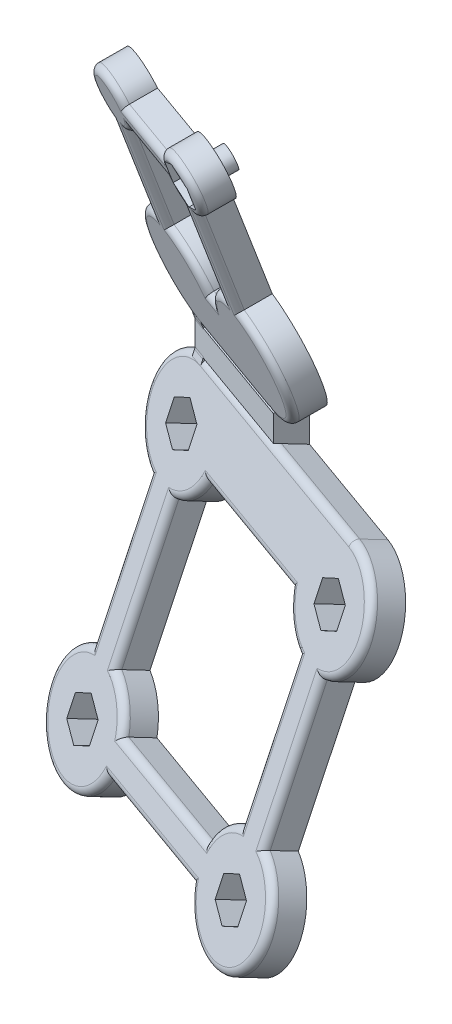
SolidWorks part; units mm, degrees
ref_plane "Plan de face" through (0, 0, 0) normal (0, 0, 1) x (1, 0, 0)
ref_plane "Plan de dessus" through (0, 0, 0) normal (0, 1, 0) x (1, 0, 0)
ref_plane "Plan de droite" through (0, 0, 0) normal (1, 0, 0) x (0, 0, -1)
sketch "Esquisse1" plane through (0, 0, 0) normal (1, 0, 0) x (0, 0, -1)
  line L0 (-6, 17) -> (0, 0) construction
  line L3 (0, 0) -> (-6, -17) construction
  dimension "D1" = 17
  dimension "D2" = 6
  dimension "D3" = 17
  dimension "D4" = 6
sketch "Esquisse2" plane through (0, 0, 0) normal (0, 1, 0) x (1, 0, 0)
  line L0 (0, 0) -> (42, -15) construction
  dimension "D1" = 42
  dimension "D2" = 15
ref_plane "Plan1" through (0, 0, 0) normal (0.3192, 0.3154, -0.8937) x (-0.9477, 0.1062, -0.301)
ref_plane "Plan2" through (0, 0, 0) normal (0.3192, -0.3154, -0.8937) x (-0.9477, -0.1062, -0.301)
sketch "Esquisse6" plane through (0, 0, 0) normal (0.3192, 0.3154, -0.8937) x (-0.9477, 0.1062, -0.301)
  line L15 (-12.9143, 33.8873) -> (-14.5229, 19.607)
  line L16 (-17.5041, 19.9429) -> (-15.8955, 34.2231)
  line L17 (-17.7887, 4.0165) -> (-0.8955, 2.1135)
  line L18 (-9.0617, 13.5998) -> (-7.2717, 13.3982)
  line L19 (-0.6109, 18.0399) -> (0.9977, 32.3201)
  line L20 (2.3702, 17.7041) -> (3.9788, 31.9843)
  line L21 (-10.4729, 35.8343) -> (-0.9494, 34.7615)
  line L22 (-10.1371, 38.8154) -> (-0.6135, 37.7426)
  line L23 (0, 0) -> (-44.3179, 4.9923) construction
  arc A12 (-10.1371, 38.8154) -> (-15.8955, 34.2231) centre (-13.9898, 37.74) ccw
  arc A13 (3.9788, 31.9843) -> (-0.6135, 37.7426) centre (2.9033, 35.837) ccw
  arc A14 (-17.5041, 19.9429) -> (-17.7887, 4.0165) centre (-16.8932, 11.9662) ccw
  arc A15 (-0.8955, 2.1135) -> (2.3702, 17.7041) centre (0, 10.0632) ccw
  arc A16 (-9.0617, 13.5998) -> (-14.5229, 19.607) centre (-16.8932, 11.9662) ccw
  arc A17 (-0.6109, 18.0399) -> (-7.2717, 13.3982) centre (0, 10.0632) ccw
  arc A18 (-0.9494, 34.7615) -> (0.9977, 32.3201) centre (2.9033, 35.837) ccw
  arc A19 (-12.9143, 33.8873) -> (-10.4729, 35.8343) centre (-13.9898, 37.74) ccw
  point P3 (0, 0)
  point P5 (0, 0)
  dimension "D1" = 8
  dimension "D4" = 1.5
  dimension "D21" = 17
  dimension "D22" = 8
  dimension "D23" = 8
  dimension "D5" = 1.5
  dimension "D6" = 2
  dimension "D25" = 1.5
  dimension "D26" = 1.5
  dimension "D30" = 1.5
  dimension "D31" = 1.5
extrude "Boss.-Extru.2" add sketch "Esquisse6" along normal blind 4.4
sketch "Esquisse7" plane through (0, 0, 0) normal (0.3192, -0.3154, -0.8937) x (-0.9477, -0.1062, -0.301)
  line L0 (-36.6693, -6.1433) -> (-0.8955, -2.1135)
  line L1 (-27.9423, -15.7267) -> (-7.2717, -13.3982)
  line L2 (0, 0) -> (-44.3179, -4.9923) construction
  line L3 (-32.4388, -21.3648) -> (-30.1103, -42.0354)
  line L4 (-1.6336, -17.8947) -> (0.6949, -38.5653)
  line L5 (-37.4074, -21.9245) -> (-35.0789, -42.5951)
  line L6 (3.335, -17.335) -> (5.6634, -38.0056)
  line L7 (-24.4722, -46.5319) -> (-3.8016, -44.2034)
  line L8 (-23.9125, -51.5004) -> (-3.2419, -49.1719)
  arc A0 (-36.6693, -6.1433) -> (-37.4074, -21.9245) centre (-35.7737, -14.0931) ccw
  arc A1 (3.335, -17.335) -> (-0.8955, -2.1135) centre (0, -10.0632) ccw
  arc A2 (-35.0789, -42.5951) -> (-23.9125, -51.5004) centre (-31.7439, -49.8668) ccw
  arc A3 (0.6949, -38.5653) -> (-3.8016, -44.2034) centre (4.0298, -45.837) ccw
  arc A4 (-7.2717, -13.3982) -> (-1.6336, -17.8947) centre (0, -10.0632) ccw
  arc A5 (-32.4388, -21.3648) -> (-27.9423, -15.7267) centre (-35.7737, -14.0931) ccw
  arc A6 (-3.2419, -49.1719) -> (5.6634, -38.0056) centre (4.0298, -45.837) ccw
  arc A7 (-24.4722, -46.5319) -> (-30.1103, -42.0354) centre (-31.7439, -49.8668) ccw
  dimension "D1" = 16
  dimension "D2" = 16
  dimension "D5" = 16
  dimension "D6" = 16
  dimension "D3" = 36
  dimension "D4" = 10.5
  dimension "D7" = 2.5
  dimension "D8" = 2.5
  dimension "D9" = 36
  dimension "D10" = 36
  dimension "D11" = 2.5
  dimension "D12" = 2.5
  dimension "D13" = 2.5
  dimension "D14" = 2.5
  dimension "D15" = 2.5
  dimension "D16" = 5
  dimension "D17" = 2
extrude "Boss.-Extru.4" add sketch "Esquisse7" along normal blind 4.4 separate body
ref_plane "Plan3" through (0, 0, 30) normal (0, 0, 1) x (1, 0, 0)
sketch "Esquisse9" plane through (1.4043, 1.3878, -3.9321) normal (0.3192, 0.3154, -0.8937) x (-0.9477, 0.1062, -0.301)
  circle A0 centre (-13.9898, 37.74) radius 1.6
  dimension "D1" = 3.2
extrude "Boss.-Extru.5" add sketch "Esquisse9" along normal blind 1.75
pattern_linear "Répétition linéaire1" count 2 spacing 17 along (0.9417, 0, 0.3363) count 2 spacing 36 along (-0.1061, 0.949, 0.297) of "Boss.-Extru.5"
sketch "Esquisse10" plane through (0, 0, 0) normal (-0.3192, -0.3154, 0.8937) x (0.9477, -0.1062, 0.301)
  circle A0 centre (13.9898, 37.74) radius 1.5
  dimension "D1" = 3
extrude "Enlèv. mat.-Extru.1" cut sketch "Esquisse10" against normal up to next
pattern_linear "Répétition linéaire2" count 2 spacing 17 count 2 spacing 36
sketch "Esquisse11" plane through (1.4043, -1.3878, -3.9321) normal (0.3192, -0.3154, -0.8937) x (-0.9477, -0.1062, -0.301)
  circle A0 centre (-31.7439, -49.8668) radius 1.6
  dimension "D1" = 3.2
extrude "Boss.-Extru.6" add sketch "Esquisse11" along normal blind 1.75
pattern_linear "Répétition linéaire3" count 2 spacing 36 along (0.1061, 0.949, -0.297) count 2 spacing 36 along (-0.9417, 0, -0.3363) of "Boss.-Extru.6"
sketch "Esquisse12" plane through (0, 0, 0) normal (-0.3192, 0.3154, 0.8937) x (0.9477, 0.1062, 0.301)
  circle A0 centre (31.7439, -49.8668) radius 1.5
  dimension "D1" = 3
extrude "Enlèv. mat.-Extru.2" cut sketch "Esquisse12" against normal up to next
pattern_linear "Répétition linéaire4" count 2 spacing 36 along (0.1061, 0.949, -0.297) count 2 spacing 36 along (-0.9417, 0, -0.3363) of "Enlèv. mat.-Extru.2"
sketch "Esquisse13" plane through (0, 0, 0) normal (-0.3192, -0.3154, 0.8937) x (0.9477, -0.1062, 0.301)
  line L0 (15.8955, 34.2231) -> (17.5041, 19.9429) construction
  line L1 (16.9003, 36.4701) -> (16.5448, 39.6255)
  line L2 (16.5448, 39.6255) -> (13.6344, 40.8954)
  line L3 (13.6344, 40.8954) -> (11.0794, 39.0099)
  line L4 (11.0794, 39.0099) -> (11.4348, 35.8544)
  line L5 (11.4348, 35.8544) -> (14.3453, 34.5845)
  line L6 (14.3453, 34.5845) -> (16.9003, 36.4701)
  circle A0 centre (13.9898, 37.74) radius 2.75 construction
  dimension "D1" = 5.5
extrude "Enlèv. mat.-Extru.3" cut sketch "Esquisse13" against normal blind 4
pattern_linear "Répétition linéaire5" count 2 spacing 36 along (0.1061, -0.949, -0.297) count 2 spacing 36 along (0.9417, 0, 0.3363) of "Enlèv. mat.-Extru.3"
sketch "Esquisse14" plane through (0, 0, 0) normal (-0.3192, 0.3154, 0.8937) x (0.9477, 0.1062, 0.301)
  line L0 (37.4074, -21.9245) -> (35.0789, -42.5951) construction
  line L1 (31.3885, -53.0223) -> (34.2989, -51.7524)
  line L2 (34.2989, -51.7524) -> (34.6544, -48.5969)
  line L3 (34.6544, -48.5969) -> (32.0994, -46.7113)
  line L4 (32.0994, -46.7113) -> (29.1889, -47.9812)
  line L5 (29.1889, -47.9812) -> (28.8335, -51.1367)
  line L6 (28.8335, -51.1367) -> (31.3885, -53.0223)
  circle A0 centre (31.7439, -49.8668) radius 2.75 construction
  dimension "D1" = 5.5
extrude "Enlèv. mat.-Extru.4" cut sketch "Esquisse14" against normal blind 4
pattern_linear "Répétition linéaire6" count 2 spacing 36 along (-0.9417, 0, -0.3363) count 2 spacing 36 along (0.1061, 0.949, -0.297) of "Enlèv. mat.-Extru.4"
sketch "Esquisse16" plane through (0, 0, 0) normal (0, 1, 0) x (1, 0, 0)
  line L0 (15.7361, -5.3729) -> (20.4448, -7.0546)
  line L1 (15.7361, -5.3729) -> (10.5902, -19.7816)
  line L2 (10.5902, -19.7816) -> (15.8995, -19.7816)
  line L3 (15.8995, -19.7816) -> (20.4448, -7.0546)
  line L4 (0, 0) -> (42, -15) construction
  line L5 (-29.7123, -30) -> (29.7123, -30) construction
  line L6 (9.9921, -3.3215) -> (8.2957, -2.7156) construction
  dimension "D1" = 5
  dimension "D2" = 15.5
  dimension "D3" = 15.3
extrude "Boss.-Extru.10" [suppressed] add sketch "Esquisse16" along normal up to surface (51.6909 mm away)
sketch "Esquisse18" [suppressed] plane through (0, 0, 18.3517) normal (0, 0, 1) x (1, 0, 0)
  line L0 (0, 0) -> (42, 0) construction
  line L1 (1.1008, 0) -> (26.1008, 0)
  line L2 (1.1008, 0) -> (1.1008, 7)
  line L3 (1.1008, 7) -> (26.1008, 7)
  line L4 (26.1008, 0) -> (26.1008, 7)
  line L6 (11.1008, 41.3365) -> (11.1008, 0) construction
  dimension "D1" = 7
  dimension "D2" = 25
  dimension "D3" = 10
extrude "Boss.-Extru.11" [suppressed] add sketch "Esquisse18" against normal blind 5
ref_plane "nervures" through (-1.0608, 9.4895, 2.9704) normal (-0.1061, 0.949, 0.297) x (0.9944, 0.1012, 0.0317)
sketch "Esquisse28" [suppressed] plane through (-1.0608, 9.4895, 2.9704) normal (-0.1061, 0.949, 0.297) x (0.9944, 0.1012, 0.0317)
  line L0 (15.7467, -5.3368) -> (4.8552, -1.6455)
  line L1 (4.8552, -1.6455) -> (4.8552, -12.2042)
  line L2 (4.8552, -12.2042) -> (12.5369, -14.8076)
  line L3 (12.5369, -14.8076) -> (15.7467, -5.3368)
  line L5 (13.9456, -10.651) -> (12.3285, -15.4227) construction
  dimension "D1" = 10
extrude "Boss.-Extru.14" [suppressed] add sketch "Esquisse28" against normal blind 5
sketch "Esquisse29" [suppressed] plane through (-1.0608, 9.4895, 2.9704) normal (-0.1061, 0.949, 0.297) x (0.9944, 0.1012, 0.0317)
  line L0 (31.3736, -10.6329) -> (20.4821, -6.9416)
  line L1 (20.4821, -6.9416) -> (18.8772, -11.6771)
  line L2 (18.8772, -11.6771) -> (31.0197, -11.6771)
  line L3 (31.0197, -11.6771) -> (31.3736, -10.6329)
  line L4 (17.6078, -15.4227) -> (19.225, -10.651) construction
  line L5 (27.2438, -15.4227) -> (17.6078, -15.4227) construction
  dimension "D1" = 5
extrude "Boss.-Extru.15" [suppressed] add sketch "Esquisse29" against normal blind 5
sketch "Esquisse30" [suppressed] plane through (20.3666, 0, 7.2738) normal (0.9417, 0, 0.3363) x (0.3363, 0, -0.9417)
  line L0 (-9.6038, 47.9168) -> (1.7511, 51.6909)
  line L1 (1.7511, 51.6909) -> (1.7511, 13.7544) construction
  line L2 (1.7511, 51.6909) -> (-9.6038, 47.9168) construction
  line L3 (1.7511, 51.6909) -> (1.7511, 13.7544)
  line L4 (1.7511, 13.7544) -> (-9.6038, 47.9168)
extrude "Enlèv. mat.-Extru.5" [suppressed] cut sketch "Esquisse30" against normal blind 5
sketch "Esquisse34" plane through (0, 0, 0) normal (0, 1, 0) x (1, 0, 0)
  line L4 (20.4448, -7.0546) -> (15.7361, -5.3729)
  line L5 (15.8995, -19.7816) -> (20.4448, -7.0546)
  line L6 (10.5902, -19.7816) -> (15.8995, -19.7816)
  line L7 (15.7361, -5.3729) -> (10.5902, -19.7816)
  line L8 (20.4448, -7.0546) -> (15.7361, -5.3729)
  line L9 (15.8995, -19.7816) -> (20.4448, -7.0546)
  line L10 (10.5902, -19.7816) -> (15.8995, -19.7816)
  line L11 (15.7361, -5.3729) -> (10.5902, -19.7816)
  dimension "D1" = 0
extrude "Boss.-Extru.17" [suppressed] add sketch "Esquisse34" against normal up to surface (46.4219 mm away)
sketch "Esquisse31" [suppressed] plane through (20.3666, 0, 7.2738) normal (0.9417, 0, 0.3363) x (0.3363, 0, -0.9417)
  line L0 (-8.0267, 43.172) -> (1.7511, 13.7544) construction
  line L1 (-3.611, 29.8866) -> (0.174, 18.4992)
  arc A0 (-3.611, 29.8866) -> (0.174, 18.4992) centre (-1.7185, 24.1929) ccw
  dimension "D1" = 12
  dimension "D2" = 20
extrude "Enlèv. mat.-Extru.6" [suppressed] cut sketch "Esquisse31" against normal blind 5
fillet "Congé1" [suppressed] radius 4
mirror "Symétrie4" [suppressed] about plane through (0, 0, 0) normal (0, 1, 0)
fillet "Congé2" [suppressed] radius 4
ref_plane "liaison" through (1.0608, 0, 0.3789) normal (-0.9417, 0, -0.3363) x (-0.3363, 0, 0.9417)
sketch "Esquisse35" plane through (1.0608, 0, 0.3789) normal (-0.9417, 0, -0.3363) x (-0.3363, 0, 0.9417)
  line L0 (-3.5446, 3.2857) -> (-3.5446, -3.2857)
  line L1 (-3.5446, 3.2857) -> (0.6308, 1.8979) construction
  line L3 (-3.5446, -3.2857) -> (0.6308, -1.8979) construction
  line L4 (0.6308, -1.8979) -> (0.6308, 1.8979)
  line L5 (-3.5446, 3.2857) -> (0.6308, 1.8979)
  line L6 (-3.5446, -3.2857) -> (0.6308, -1.8979)
extrude "Boss.-Extru.18" add sketch "Esquisse35" against normal up to vertex
sketch "Esquisse36" [suppressed] plane through (0, 0, 18.3517) normal (0, 0, 1) x (1, 0, 0)
  line L0 (0, 0) -> (42, 0) construction
  line L1 (26.1008, -7) -> (26.1008, 7) construction
  circle A0 centre (21.1008, 0) radius 2.15
  dimension "D1" = 4.3
  dimension "D2" = 5
extrude "Enlèv. mat.-Extru.7" [suppressed] cut sketch "Esquisse36" against normal blind 5
pattern_linear "Répétition linéaire7" [suppressed] count 2 spacing 15
sketch "Esquisse39" [suppressed] plane through (0, 0, 13.3517) normal (0, 0, -1) x (-1, 0, 0)
  circle A0 centre (-6.1008, 0) radius 5
  dimension "D1" = 10
extrude "Enlèv. mat.-Extru.13" [suppressed] cut sketch "Esquisse39" along normal through all
pattern_linear "Répétition linéaire8" [suppressed] count 2 spacing 15
fillet "Congé40" radius 1 3 edges at (-7.3047, -8.2882, 0.3164) (17.8, -1.8979, 7.027) (41.476, -8.2882, 17.7381)
fillet "Congé5" radius 1
fillet "Congé38" radius 1
fillet "Congé6" radius 1
fillet "Congé7" [suppressed] radius 1
fillet "Congé13" radius 1 5 edges at (34.4038, -26.0673, 21.4873) (34.8108, -49.02, 29.7336) (-9.7465, -49.02, 13.8203) (12.8671, -46.0243, 20.8393) (-4.2076, -26.0673, 7.6975)
fillet "Congé14" radius 1 8 edges at (16.6861, -11.8619, 10.1459) (4.7272, -14.8576, 6.9322) (0.4448, -26.5707, 9.5368) (2.1083, -38.2838, 14.2649) (13.3975, -41.2795, 19.3541) (25.3565, -38.2838, 22.5678) (29.6388, -26.5707, 19.9632) (27.9753, -14.8576, 15.2351)
fillet "Congé16" [suppressed] radius 1
fillet "Congé19" [suppressed] radius 1
fillet "Congé20" [suppressed] radius 1
fillet "Congé37" radius 1 1 edges at (23.536, 9.5545, 11.7779)
fillet "Congé39" radius 1 2 edges at (-7.4205, 8.7747, 0.4467) (7.9464, 1.8979, 3.5079)
fillet "Congé22" radius 1
fillet "Congé26" radius 1 8 edges at (7.7396, 11.8619, 6.9507) (4.3347, 15.193, 6.9103) (-0.1833, 23.765, 8.3222) (0.2122, 31.4183, 11.1646) (5.4124, 32.6789, 13.4667) (10.8945, 31.4183, 14.9797) (13.0011, 23.765, 13.0309) (10.3998, 15.193, 9.0764)
fillet "Congé29" radius 1 5 edges at (5.0942, 35.5258, 14.3579) (-2.9543, 23.2807, 7.1616) (15.8805, 23.2807, 13.8883) (-5.7152, 36.7864, 10.9423) (15.6217, 36.7864, 18.5626)
fillet "Congé36" [suppressed] radius 1
fillet "Congé41" [suppressed] radius 1
fillet "Congé42" [suppressed] radius 1
fillet "Congé43" [suppressed] radius 1
fillet "Congé44" [suppressed] radius 1
fillet "Congé45" [suppressed] radius 1
fillet "Congé46" [suppressed] radius 1
fillet "Congé47" [suppressed] radius 1
fillet "Congé48" [suppressed] radius 1
fillet "Congé49" [suppressed] radius 1
fillet "Congé50" [suppressed] radius 1
fillet "Congé51" [suppressed] radius 1
fillet "Congé52" [suppressed] radius 1
fillet "Congé53" [suppressed] radius 1
fillet "Congé54" [suppressed] radius 1
fillet "Congé55" [suppressed] radius 1
fillet "Congé57" [suppressed] radius 1
fillet "Congé58" [suppressed] radius 1
sketch "Esquisse40" plane through (1.0608, 0, 0.3789) normal (-0.9417, 0, -0.3363) x (-0.3363, 0, 0.9417)
  line L0 (-4.7475, -4.7393) -> (0.9462, -2.8469)
  line L1 (-4.7475, -4.7393) -> (-5.0629, -3.7904)
  line L2 (-5.0629, -3.7904) -> (-5.0629, 3.7904)
  line L3 (0.6308, -1.7361) -> (0.6308, 1.8979) construction
  line L4 (0.6819, -2.0515) -> (0.9462, -2.8469) construction
  line L5 (0.6308, -1.7361) -> (0.6308, 1.7361)
  line L6 (0.6819, -2.0515) -> (0.9462, -2.8469)
  line L7 (19.5403, 0) -> (-19.5403, 0) construction
  line L8 (-5.0629, -3.7904) -> (-0.1427, -18.5935) construction
  line L9 (-5.0629, -3.7904) -> (-0.3181, -2.2133) construction
  line L10 (0.6819, 2.0515) -> (0.9462, 2.8469)
  line L11 (-4.7475, 4.7393) -> (-5.0629, 3.7904)
  line L12 (-4.7475, 4.7393) -> (0.9462, 2.8469)
  arc A0 (0.6308, -1.7361) -> (0.6819, -2.0515) centre (1.6308, -1.7361) ccw construction
  arc A1 (0.6308, -1.7361) -> (0.6819, -2.0515) centre (1.6308, -1.7361) ccw
  arc A2 (0.6308, 1.7361) -> (0.6819, 2.0515) centre (1.6308, 1.7361) cw
  point P19 (0.6308, 0)
  point P23 (-5.0629, 0)
extrude "Boss.-Extru.19" add sketch "Esquisse40" along normal blind 2
fillet "Congé60" radius 1
